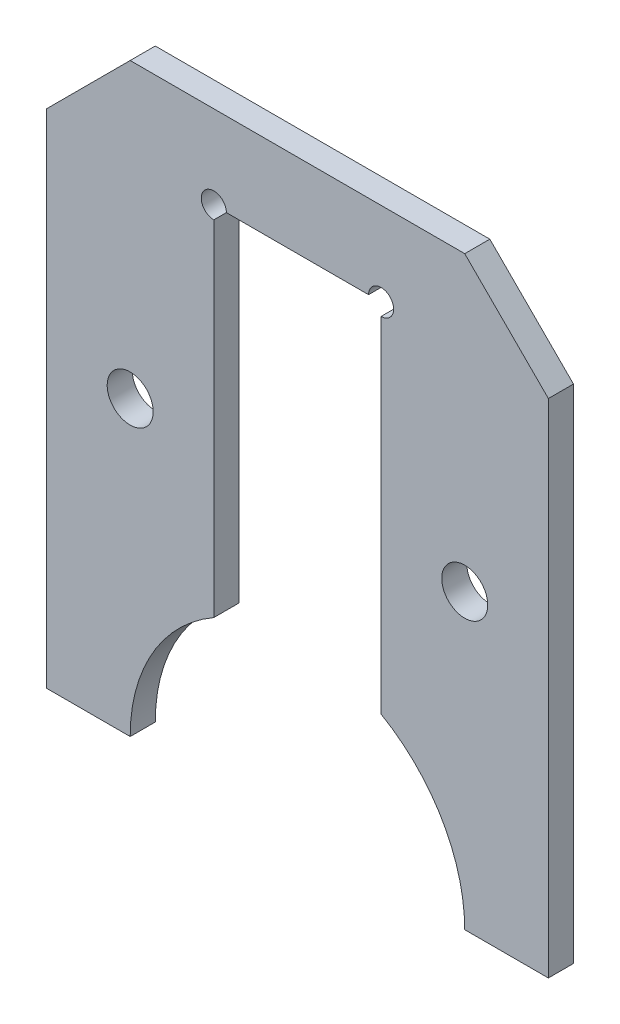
SolidWorks part; units mm, degrees
ref_plane "Front Plane" through (0, 0, 0) normal (0, 0, 1) x (1, 0, 0)
ref_plane "Top Plane" through (0, 0, 0) normal (0, 1, 0) x (1, 0, 0)
ref_plane "Right Plane" through (0, 0, 0) normal (1, 0, 0) x (0, 0, -1)
sketch "Sketch1" plane through (0, 0, 0) normal (0, 0, 1) x (1, 0, 0)
  line L0 (0, 0) -> (0, 70) construction
  line L1 (-20, 70) -> (20, 70)
  line L2 (30, 60) -> (30, 0)
  line L3 (30, 0) -> (20, 0)
  line L4 (10, 17.3205) -> (10, 58.5)
  line L5 (8.5, 60) -> (-8.5, 60)
  line L6 (20, 70) -> (30, 60)
  line L7 (-10, 17.3205) -> (-10, 58.5)
  line L8 (-30, 0) -> (-20, 0)
  line L9 (-30, 60) -> (-30, 0)
  line L10 (-20, 70) -> (-30, 60)
  arc A0 (20, 0) -> (10, 17.3205) centre (0, 0) ccw
  circle A1 centre (20, 35) radius 2.75
  arc A2 (10, 58.5) -> (8.5, 60) centre (10, 60) ccw
  arc A3 (-10, 58.5) -> (-8.5, 60) centre (-10, 60) cw
  circle A4 centre (-20, 35) radius 2.75
  arc A5 (-20, 0) -> (-10, 17.3205) centre (0, 0) cw
  point P4 (30, 70)
  point P16 (0, 60)
  dimension "D2" = 5.5
  dimension "D3" = 20
  dimension "D4" = 20
  dimension "D5" = 35
  dimension "D6" = 1.5
  dimension "D7" = 10
  dimension "D1" = 30
  dimension "D8" = 10
  dimension "D9" = 10
  dimension "D10" = 10
  dimension "D11" = 10
  dimension "D12" = 70
extrude "Extrude1" add sketch "Sketch1" along normal blind 3
